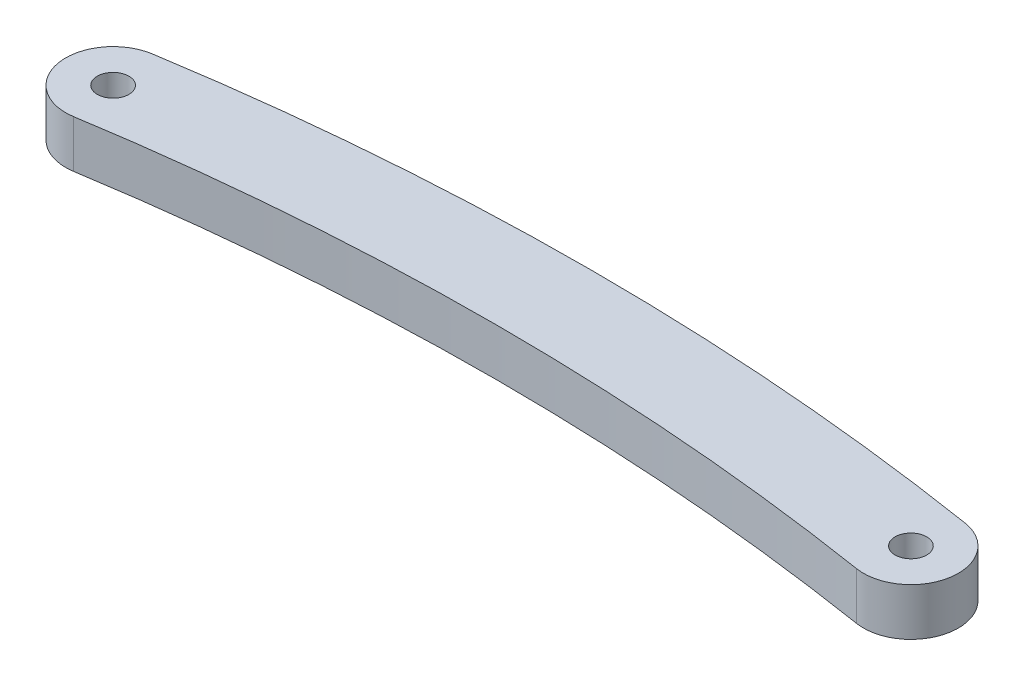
SolidWorks part; units mm, degrees
ref_plane "Plan de face" through (0, 0, 0) normal (0, 0, 1) x (1, 0, 0)
ref_plane "Plan de dessus" through (0, 0, 0) normal (0, 1, 0) x (1, 0, 0)
ref_plane "Plan de droite" through (0, 0, 0) normal (1, 0, 0) x (0, 0, -1)
sketch "Esquisse1" plane through (0, 0, 0) normal (0, 1, 0) x (1, 0, 0)
  line L0 (-25.2209, 0) -> (25.2209, 0) construction
  arc A0 (-25.2209, 0) -> (25.2209, 0) centre (0, -158.0232) cw construction
  arc A1 (25.6937, 2.9625) -> (-25.6937, 2.9625) centre (0, -158.0232) ccw
  arc A2 (24.7481, -2.9625) -> (-24.7481, -2.9625) centre (0, -158.0232) ccw
  arc A3 (24.7481, -2.9625) -> (25.6937, 2.9625) centre (25.2209, 0) ccw
  arc A4 (-25.6937, 2.9625) -> (-24.7481, -2.9625) centre (-25.2209, 0) ccw
  circle A5 centre (25.2209, 0) radius 1
  circle A6 centre (-25.2209, 0) radius 1
  point P3 (0, 2)
  dimension "D3" = 3
  dimension "D4" = 2
  dimension "D1" = 50.4418
  dimension "D2" = 2
extrude "Boss.-Extru.1" add sketch "Esquisse1" along normal blind 3
